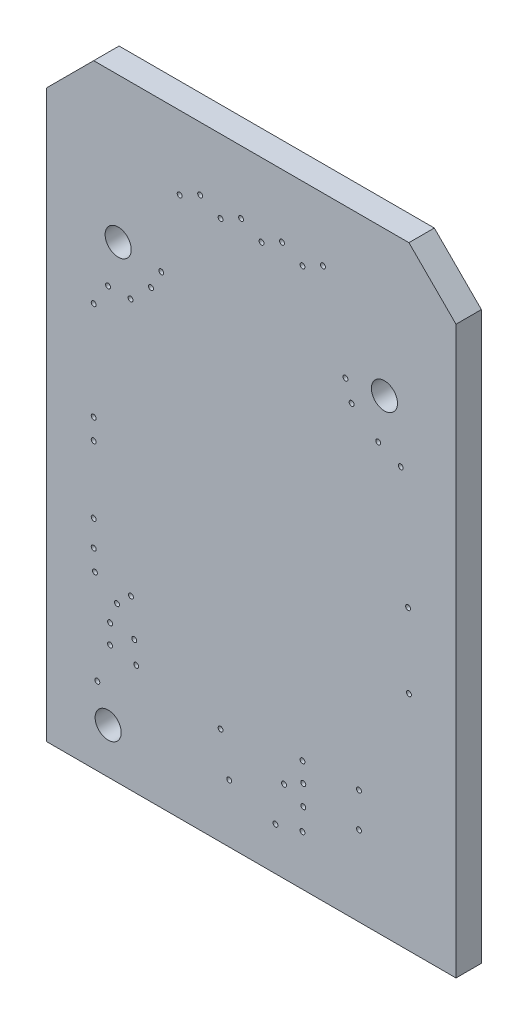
SolidWorks part; units mm, degrees
ref_plane "Front Plane" through (0, 0, 0) normal (0, 0, 1) x (1, 0, 0)
ref_plane "Top Plane" through (0, 0, 0) normal (0, 1, 0) x (1, 0, 0)
ref_plane "Right Plane" through (0, 0, 0) normal (1, 0, 0) x (0, 0, -1)
ref_plane "Dielectric_Layer Layer 1" through (0, 0, 0.7874) normal (0, 0, 1) x (1, 0, 0)
sketch "Sketch1" plane through (0, 0, 0) normal (0, 0, 1) x (1, 0, 0)
  line L0 (0, 0) -> (12.7, 0)
  line L1 (12.7, 0) -> (12.7, 17.5641)
  line L2 (12.7, 17.5641) -> (11.2395, 19.0246)
  line L3 (11.2395, 19.0246) -> (1.4605, 19.0246)
  line L4 (1.4605, 19.0246) -> (0, 17.5641)
  line L5 (0, 17.5641) -> (0, 0)
extrude "Board_Outline" add sketch "Sketch1" along normal blind 0.7874 separate body
sketch "Sketch2" plane through (0, 0, 0) normal (0, 0, 1) x (1, 0, 0)
  circle A0 centre (1.4605, 9.4488) radius 0.0762
  circle A1 centre (9.6901, 2.4765) radius 0.0762
  circle A2 centre (1.4986, 5.3086) radius 0.0762
  circle A3 centre (11.2141, 9.2075) radius 0.0762
  circle A4 centre (1.4605, 12.4968) radius 0.0762
  circle A5 centre (1.4605, 8.8138) radius 0.0762
  circle A6 centre (6.0325, 17.0688) radius 0.0762
  circle A7 centre (1.905, 13.1953) radius 0.0762
  circle A8 centre (5.3975, 16.7513) radius 0.0762
  circle A9 centre (2.6035, 13.1953) radius 0.0762
  circle A10 centre (4.7625, 17.0688) radius 0.0762
  circle A11 centre (3.2385, 13.8176) radius 0.0762
  circle A12 centre (4.1275, 16.7513) radius 0.0762
  circle A13 centre (3.556, 14.4018) radius 0.0762
  circle A14 centre (7.9629, 2.8575) radius 0.0762
  circle A15 centre (2.1844, 4.8006) radius 0.0762
  circle A16 centre (8.5725, 17.0688) radius 0.0762
  circle A17 centre (9.271, 14.4018) radius 0.0762
  circle A18 centre (7.9375, 16.7513) radius 0.0762
  circle A19 centre (9.4615, 13.8176) radius 0.0762
  circle A20 centre (7.3025, 17.0688) radius 0.0762
  circle A21 centre (10.287, 13.1953) radius 0.0762
  circle A22 centre (6.6675, 16.7513) radius 0.0762
  circle A23 centre (10.9855, 12.8778) radius 0.0762
  circle A24 centre (7.9375, 3.4544) radius 0.0762
  circle A25 centre (2.7813, 3.4417) radius 0.0762
  circle A26 centre (5.3975, 3.0353) radius 0.0762
  circle A27 centre (1.5748, 2.413) radius 0.0762
  circle A28 centre (7.9629, 2.2352) radius 0.0762
  circle A29 centre (2.6162, 5.2197) radius 0.0762
  circle A30 centre (5.6642, 1.8034) radius 0.0762
  circle A31 centre (7.9375, 1.5494) radius 0.0762
  circle A32 centre (7.0993, 1.3335) radius 0.0762
  circle A33 centre (7.366, 2.54) radius 0.0762
  circle A34 centre (1.4605, 6.731) radius 0.0762
  circle A35 centre (11.2395, 6.9088) radius 0.0762
  circle A36 centre (1.9685, 3.5814) radius 0.0762
  circle A37 centre (9.6901, 3.5433) radius 0.0762
  circle A38 centre (1.4605, 5.9309) radius 0.0762
  circle A39 centre (1.9685, 4.1783) radius 0.0762
  circle A40 centre (2.7178, 4.1021) radius 0.0762
extrude "NPTH" cut sketch "Sketch2" along normal through all
sketch "Sketch3" plane through (0, 0, 0) normal (0, 0, 1) x (1, 0, 0)
  circle A0 centre (2.22, 14.53) radius 0.405
  circle A1 centre (10.48, 14.53) radius 0.405
  circle A2 centre (1.91, 1.4) radius 0.405
extrude "PTH" cut sketch "Sketch3" along normal through all
